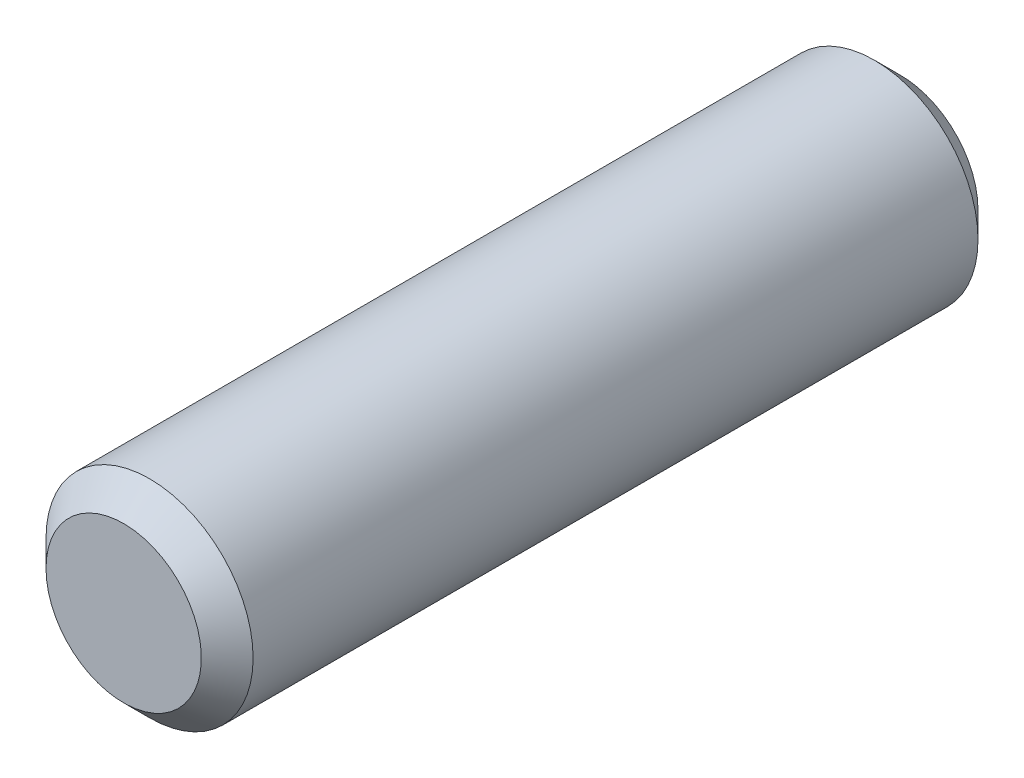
SolidWorks part; units mm, degrees
ref_plane "Plan de face" through (0, 0, 0) normal (0, 0, 1) x (1, 0, 0)
ref_plane "Plan de dessus" through (0, 0, 0) normal (0, 1, 0) x (1, 0, 0)
ref_plane "Plan de droite" through (0, 0, 0) normal (1, 0, 0) x (0, 0, -1)
sketch "Esquisse1" plane through (0, 0, 0) normal (0, 0, 1) x (1, 0, 0)
  circle A0 centre (0, 0) radius 2
  dimension "D1" = 4
extrude "Extrusion1" add sketch "Esquisse1" along normal mid plane 15
chamfer "Chanfrein1" distance 0.5 angle 45 2 edges at (2, 0, -7.5) (2, 0, 7.5)
